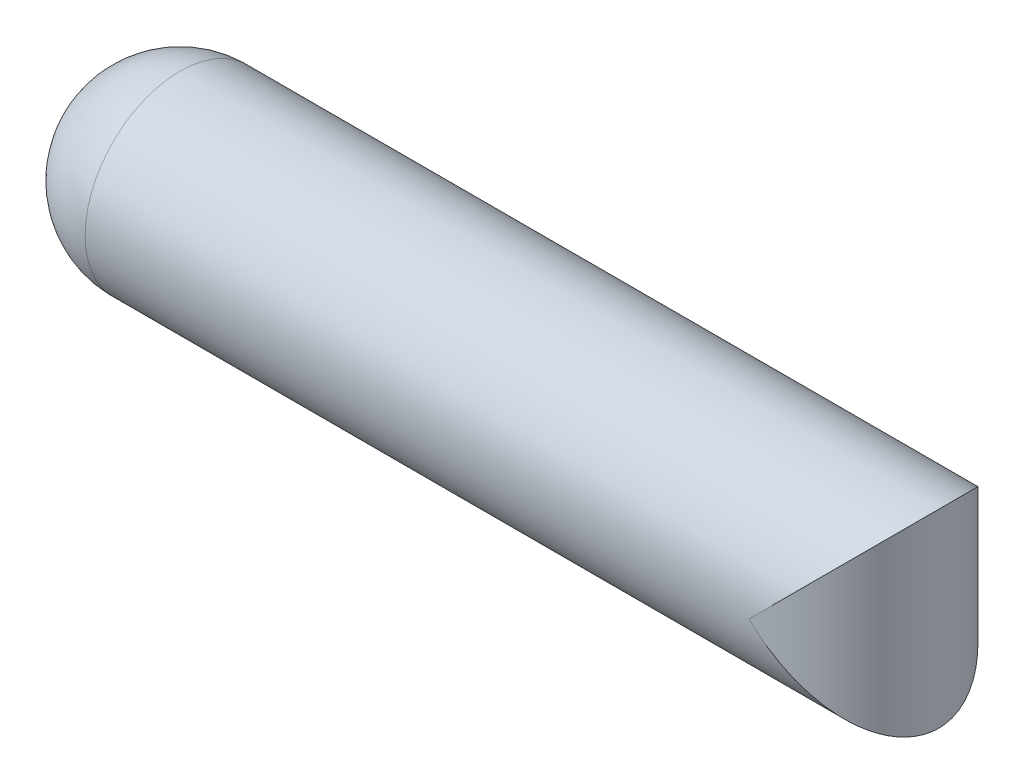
SolidWorks part; units mm, degrees
ref_plane "Front Plane" through (0, 0, 0) normal (0, 0, 1) x (1, 0, 0)
ref_plane "Top Plane" through (0, 0, 0) normal (0, 1, 0) x (1, 0, 0)
ref_plane "Right Plane" through (0, 0, 0) normal (1, 0, 0) x (0, 0, -1)
sketch "Sketch1" plane through (0, 0, 0) normal (1, 0, 0) x (0, 0, -1)
  circle A0 centre (0, 0) radius 50.8
  dimension "D1" = 101.6
extrude "Boss-Extrude1" add sketch "Sketch1" along normal blind 457.2
fillet "Fillet1" radius 50.8 1 edges at (0, 0, -50.8)
sketch "Sketch2" plane through (0, 0, 0) normal (0, 1, 0) x (1, 0, 0)
  line L0 (457.2, -50.8) -> (457.2, 50.8) construction
  line L1 (406.4, 50.8) -> (481.9303, 50.8)
  line L2 (481.9303, 50.8) -> (481.9303, -50.8)
  line L3 (481.9303, -50.8) -> (406.4, -50.8)
  arc A0 (406.4, -50.8) -> (406.4, 50.8) centre (406.4, 0) ccw
  dimension "D1" = 101.6
extrude "Cut-Extrude1" cut sketch "Sketch2" against normal through all and the other way through all
